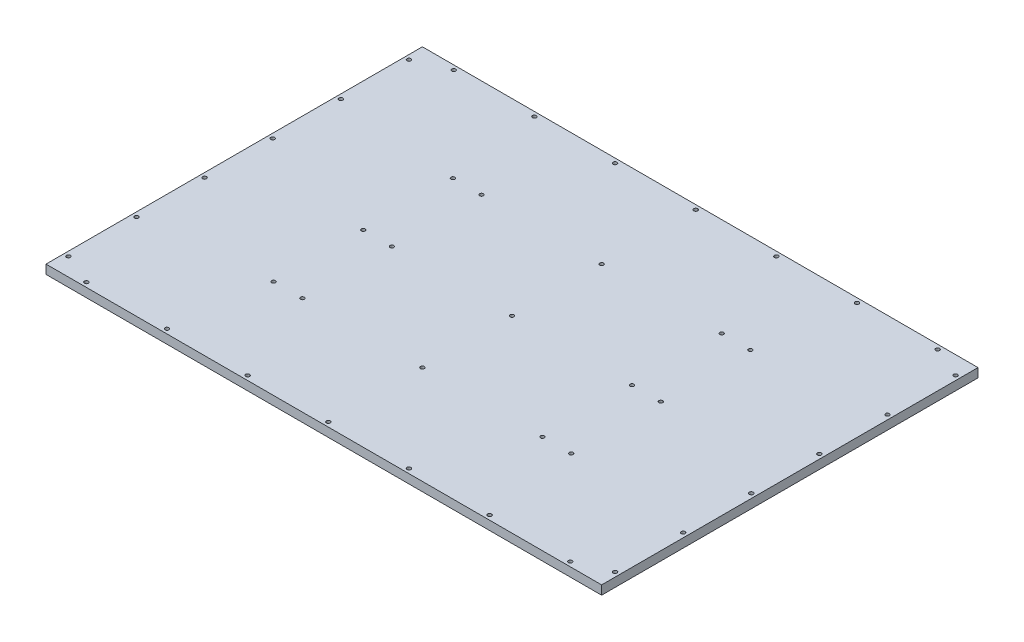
SolidWorks part; units mm, degrees
ref_plane "Спереди" through (0, 0, 0) normal (0, 0, 1) x (1, 0, 0)
ref_plane "Сверху" through (0, 0, 0) normal (0, 1, 0) x (1, 0, 0)
ref_plane "Справа" through (0, 0, 0) normal (1, 0, 0) x (0, 0, -1)
sketch "Эскиз1" plane through (0, 0, 0) normal (0, 1, 0) x (1, 0, 0)
  line L1 (310, 210) -> (-310, 210)
  line L2 (310, 210) -> (310, -210)
  line L3 (310, -210) -> (-310, -210)
  line L4 (-310, 210) -> (-310, -210)
  point P0 (0, 0)
  point P6 (0, 210)
  point P7 (-310, 0)
  dimension "D1" = 620
  dimension "D2" = 420
extrude "Бобышка-Вытянуть1" add sketch "Эскиз1" along normal blind 10
sketch "Эскиз5" [suppressed] plane through (0, 0, 0) normal (0, -1, 0) x (1, 0, 0)
  line L0 (-300, 200) -> (300, 200) construction
  line L2 (310, -210) -> (-310, -210) construction
  line L3 (-310, 210) -> (310, 210) construction
  line L5 (-300, 200) -> (-300, -200) construction
  line L7 (300, 200) -> (300, -200) construction
  line L8 (-300, -200) -> (300.0084, -200) construction
  line L10 (-300, 108) -> (300, 108) construction
  line L11 (-300, 108) -> (-300, 92) construction
  line L12 (-300, 92) -> (300, 92) construction
  line L13 (300, 108) -> (300, 92) construction
  line L14 (-300, -92) -> (300, -92) construction
  line L15 (-300, -92) -> (-300, -108) construction
  line L16 (-300, -108) -> (300, -108) construction
  line L17 (300, -92) -> (300, -108) construction
  line L18 (300, 0) -> (-300, 0) construction
  arc A0 (100, -108) -> (100, 108) centre (100, 0) ccw construction
  arc A1 (-126, -108) -> (-192, -200) centre (-100.0756, -196.2719) ccw construction
  arc A2 (-126, -92) -> (-208, -200) centre (-100.0464, -196.8352) ccw construction
  arc A3 (100, -92) -> (100, 92) centre (100, 0) ccw construction
  arc A4 (-126, 92) -> (-208, 200) centre (-100.0464, 196.8352) cw construction
  arc A5 (-126, 108) -> (-192, 200) centre (-100.0756, 196.2719) cw construction
  point P39 (208, 0)
  point P43 (192, 0)
  dimension "D9" = 92
  dimension "D13" = 108
  dimension "D10" = 108
  dimension "D12" = 92
  dimension "D14" = 92
  dimension "D11" = 108
  dimension "D2" = 400
  dimension "D3" = 92
  dimension "D4" = 108
  dimension "D5" = 174
  dimension "D6" = 10
  dimension "D7" = 10
  dimension "D15" = 92
hole_wizard "Диаметр отверстия Ø4.3 (4.3)1" positions "Эскиз8" profile "Эскиз9" hole size "Ø4.3" standard "ISO"
sketch "Эскиз8" plane through (1.473, 0, 2.9376) normal (0, -1, 0) x (1, 0, 0)
  line L6 (308.527, 207.0624) -> (308.527, -212.9376) construction
  line L7 (308.527, -212.9376) -> (-311.473, -212.9376) construction
  line L8 (-311.473, -212.9376) -> (-311.473, 207.0624) construction
  point P0 (303.527, 187.0624)
  point P3 (303.527, 111.0624)
  point P6 (303.527, 35.0624)
  point P9 (303.527, -40.9376)
  point P16 (178.527, 202.0624)
  point P19 (88.527, 202.0624)
  point P22 (-1.473, 202.0624)
  point P25 (-91.473, 202.0624)
  point P30 (268.527, 202.0624)
  point P33 (-181.473, 202.0624)
  point P36 (-271.473, 202.0624)
  point P39 (-306.473, 187.0624)
  point P42 (-306.473, 111.0624)
  point P45 (-306.473, 35.0624)
  point P48 (-306.473, -40.9376)
  point P51 (-306.473, -116.9376)
  point P54 (-306.473, -192.9376)
  point P57 (-271.473, -207.9376)
  point P60 (-181.473, -207.9376)
  point P63 (-91.473, -207.9376)
  point P66 (-1.473, -207.9376)
  point P69 (88.527, -207.9376)
  point P72 (178.527, -207.9376)
  point P75 (268.527, -207.9376)
  point P78 (303.527, -192.9376)
  point P81 (303.527, -116.9376)
  dimension "D1" = 40
  dimension "D2" = 40
  dimension "D3" = 90
  dimension "D4" = 90
  dimension "D5" = 90
  dimension "D6" = 90
  dimension "D7" = 90
  dimension "D8" = 90
  dimension "D9" = 5
  dimension "D10" = 615
  dimension "D11" = 40
other "Выровнять группу1"
other "Выровнять группу2"
sketch "Эскиз9" plane through (305, 0, 190) normal (1, 0, 0) x (0, 0, -1)
  line L0 (0, 0) -> (0, 10)
  line L1 (0, 10) -> (2.15, 10)
  line L2 (2.15, 10) -> (2.15, 0)
  line L5 (2.15, 0) -> (0, 0)
  line L11 (0, -6.35) -> (0, 107.95) construction
  dimension "Диаметр сквозного отверстия" = 4.3
  dimension "Глубина сквозного отверстия" = 10
hole_wizard "Отверстия под штифты Ø8.0 мм1" positions "Эскиз16" profile "Эскиз17" hole size "Ø8.0" standard "ISO"
sketch "Эскиз16" plane through (1.473, -590.0084, -210) normal (0, 0, -1) x (-1, 0, 0)
  line L0 (-308.527, 600.0084) -> (-308.527, 590.0084) construction
  line L1 (311.473, 600.0084) -> (311.473, 590.0084) construction
  line L2 (-308.527, 600.0084) -> (311.473, 600.0084) construction
  arc A0 (-152.5588, 600.0084) -> (-144.4308, 600.0084) centre (-148.4948, 600.0084) ccw
  point P0 (-148.527, 600.0084)
  point P4 (151.473, 600.0084)
  dimension "D1" = 160
  dimension "D2" = 160
sketch "Эскиз17" plane through (150, 10, -210) normal (1, 0, 0) x (0, 1, 0)
  line L0 (0, 0) -> (0, 420)
  line L1 (0, 420) -> (4, 420)
  line L2 (4, 420) -> (4, 0)
  line L3 (4, 0) -> (0, 0)
  line L4 (0, -6.35) -> (0, 107.95) construction
  dimension "Диаметр сквозного отверстия" = 8
  dimension "Глубина сквозного отверстия" = 420
hole_wizard "Отверстие обработанное метчиком M51" positions "Эскиз23" profile "Эскиз24" tap size "M5" standard "DIN"
sketch "Эскиз23" plane through (0, 10, 0) normal (0, 1, 0) x (1, 0, 0)
  line L0 (310, -210) -> (310, 210) construction
  line L1 (310, 210) -> (-310, 210) construction
  point P0 (166, 100)
  point P2 (166, 0)
  point P4 (166, -100)
  point P6 (134, -100)
  point P8 (134, 0)
  point P10 (134, 100)
  point P12 (0, 100)
  point P14 (0, 0)
  point P16 (0, -100)
  point P18 (-134, -100)
  point P20 (-134, 0)
  point P22 (-134, 100)
  point P24 (-166, 100)
  point P26 (-166, 0)
  point P28 (-166, -100)
  dimension "D1" = 32
  dimension "D2" = 310
  dimension "D3" = 444
  dimension "D4" = 32
  dimension "D5" = 144
  dimension "D6" = 110
  dimension "D7" = 100
  dimension "D8" = 100
sketch "Эскиз24" plane through (166, 10, -100) normal (1, 0, 0) x (0, 0, 1)
  line L0 (0, 0) -> (0, 11.2618)
  line L1 (0, 11.2618) -> (2.1, 10)
  line L2 (2.1, 10) -> (2.1, 0)
  line L5 (2.1, 0) -> (0, 0)
  line L10 (0, 11.2618) -> (-2.1, 10) construction
  line L11 (0, -6.35) -> (0, 107.95) construction
  dimension "Диаметр сверла" = 4.2
  dimension "Глубина сверла" = 10
  dimension "Угол заточки сверла" = 118
